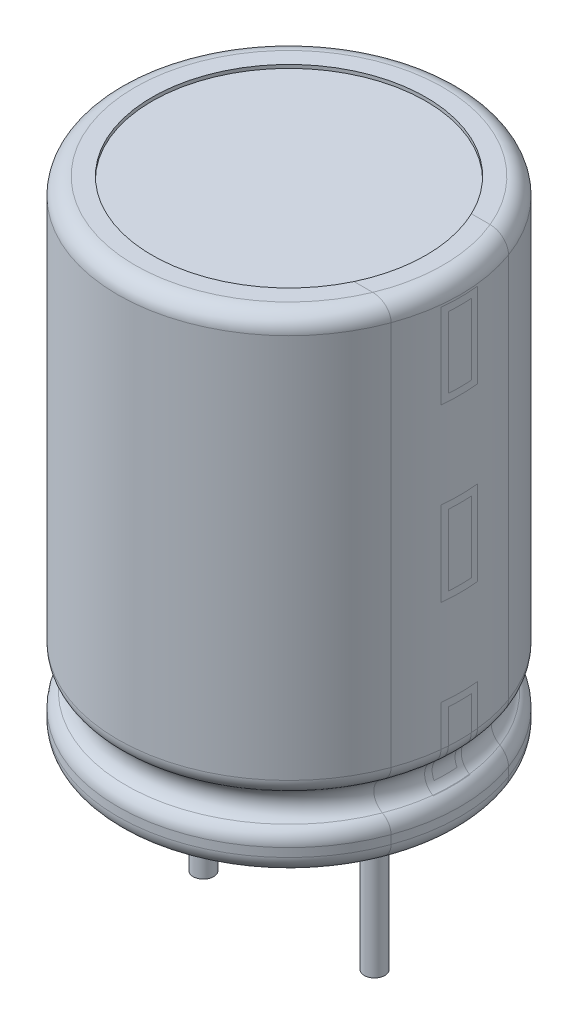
SolidWorks part; units mm, degrees
ref_plane "Front Plane" through (0, 0, 0) normal (0, 0, 1) x (1, 0, 0)
ref_plane "Top Plane" through (0, 0, 0) normal (0, 1, 0) x (1, 0, 0)
ref_plane "Right Plane" through (0, 0, 0) normal (1, 0, 0) x (0, 0, -1)
sketch "Sketch1" plane through (0, 0, 0) normal (0, 1, 0) x (1, 0, 0)
  line L0 (0, 0) -> (0, 44.7542) construction
  line L1 (0, 0) -> (-44.7542, 0) construction
  circle A0 centre (-2.5, 0) radius 0.3
  circle A1 centre (2.5, 0) radius 0.3
  dimension "D3" = 0.6
extrude "Boss-Extrude1" add sketch "Sketch1" against normal blind 4.72
sketch "Sketch3" plane through (0, 0, 0) normal (0, 0, 1) x (1, 0, 0)
  line L0 (0, 0) -> (-4.6285, 0) construction
  line L1 (0, 0) -> (0, 14.1) construction
  line L2 (5, 0.4) -> (5, 0.6505)
  line L3 (0, 0) -> (4, 0)
  line L4 (4, 14.1) -> (4.5, 14.1)
  line L5 (4, -0.1) -> (4.5, -0.1)
  line L6 (0, 14) -> (4, 14)
  line L7 (5, 2.3495) -> (5, 13.6)
  line L8 (4, 14) -> (4, 14.1)
  line L9 (5, 2.3495) -> (5, 14.1) construction
  line L10 (4, -0.1) -> (4, 0)
  line L11 (0, 14) -> (5, 14) construction
  line L12 (0, 14.1) -> (5, 14.1) construction
  line L13 (4, 2.3495) -> (4, 14.1) construction
  line L14 (0, 0) -> (0, 14)
  line L17 (0, 0) -> (5, 0) construction
  line L18 (0, -0.1) -> (5, -0.1) construction
  arc A0 (4.7644, 1.9251) -> (4.7644, 1.0749) centre (5.0292, 1.5) ccw
  arc A1 (5, 0.6505) -> (4.7644, 1.0749) centre (4.5, 0.6505) ccw
  arc A2 (5, 2.3495) -> (4.7644, 1.9251) centre (4.5, 2.3495) cw
  arc A3 (5, 13.6) -> (4.5, 14.1) centre (4.5, 13.6) ccw
  arc A4 (4.5, -0.1) -> (5, 0.4) centre (4.5, 0.4) ccw
  point P13 (5, 2)
  dimension "D2" = 0.5
  dimension "D1" = 0.5
  dimension "D3" = 14
  dimension "D4" = 0.1
  dimension "D5" = 1
revolve "Revolve1" add sketch "Sketch3" angle 360 about L14
sketch "Sketch4" plane through (0, 0, 0) normal (1, 0, 0) x (0, 0, -1)
  line L0 (-4.5, -0.1) -> (4.5, -0.1) construction
  line L1 (-1.7148, -0.1) -> (1.7148, -0.1)
  line L2 (0, -0.1) -> (0, 14.1) construction
  line L3 (-1.7148, 14.1) -> (1.7148, 14.1)
  line L4 (1.7148, -0.1) -> (1.7148, 14.1)
  line L5 (4, 14.1) -> (-4, 14.1) construction
  line L6 (-1.7148, -0.1) -> (-1.7148, 14.1)
  line L7 (-0.3349, 13.3362) -> (-0.3349, 11.2664)
  line L8 (-0.3349, 13.3362) -> (0.3349, 13.3362)
  line L9 (0, 13.3362) -> (0, 11.2664) construction
  line L10 (-0.3349, 11.2664) -> (0.3349, 11.2664)
  line L11 (0.3349, 13.3362) -> (0.3349, 11.2664)
  line L12 (0.5349, 13.5362) -> (0.5349, 11.0664)
  line L13 (-0.5349, 11.0664) -> (0.5349, 11.0664)
  line L14 (-0.5349, 13.5362) -> (-0.5349, 11.0664)
  line L15 (-0.5349, 13.5362) -> (0.5349, 13.5362)
  line L16 (0, -0.1) -> (0, -3.7489) construction
  line L17 (-0.3349, 8.3362) -> (-0.3349, 6.2664)
  line L18 (-0.3349, 8.3362) -> (0.3349, 8.3362)
  line L19 (-0.3349, 6.2664) -> (0.3349, 6.2664)
  line L20 (0.3349, 8.3362) -> (0.3349, 6.2664)
  line L21 (0.5349, 8.5362) -> (0.5349, 6.0664)
  line L22 (-0.5349, 6.0664) -> (0.5349, 6.0664)
  line L23 (-0.5349, 8.5362) -> (-0.5349, 6.0664)
  line L24 (-0.5349, 8.5362) -> (0.5349, 8.5362)
  line L25 (0, 8.3362) -> (0, 6.2664) construction
  line L26 (-0.3349, 3.3362) -> (-0.3349, 1.2664)
  line L27 (-0.3349, 3.3362) -> (0.3349, 3.3362)
  line L28 (-0.3349, 1.2664) -> (0.3349, 1.2664)
  line L29 (0.3349, 3.3362) -> (0.3349, 1.2664)
  line L30 (0.5349, 3.5362) -> (0.5349, 1.0664)
  line L31 (-0.5349, 1.0664) -> (0.5349, 1.0664)
  line L32 (-0.5349, 3.5362) -> (-0.5349, 1.0664)
  line L33 (-0.5349, 3.5362) -> (0.5349, 3.5362)
  line L34 (0, 3.3362) -> (0, 1.2664) construction
  dimension "D1" = 0.2
  dimension "D2" = 3
